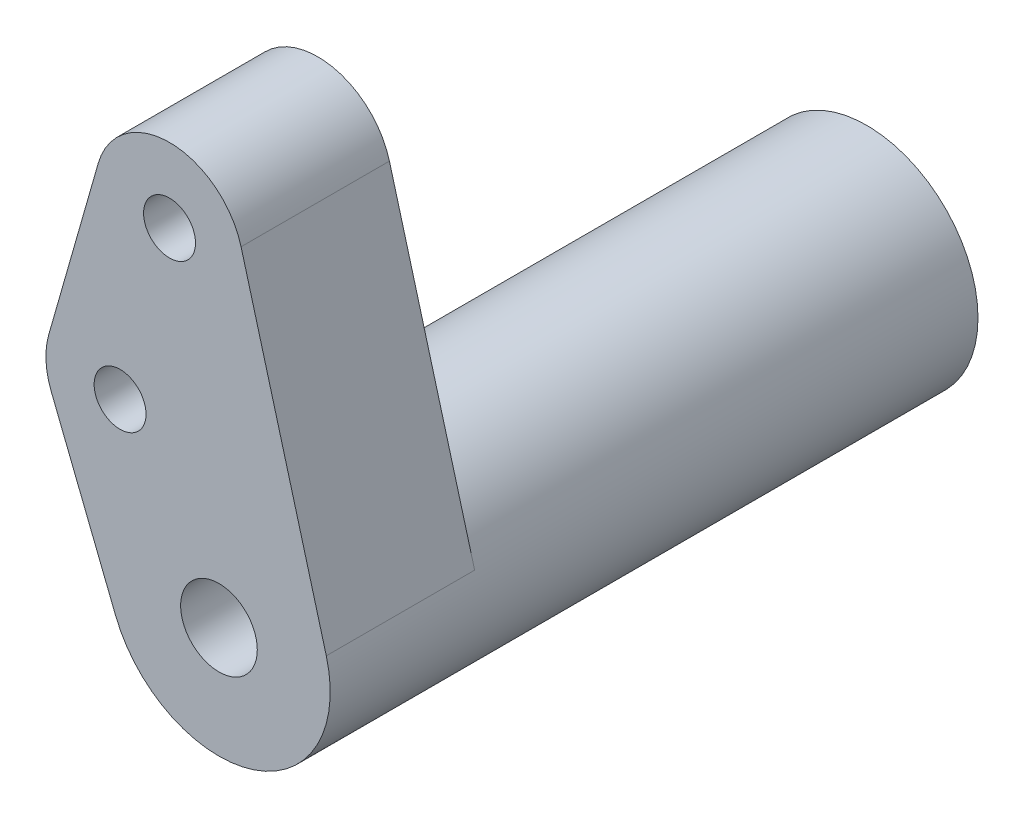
SolidWorks part; units mm, degrees
ref_plane "Alzado" through (0, 0, 0) normal (0, 0, 1) x (1, 0, 0)
ref_plane "Planta" through (0, 0, 0) normal (0, 1, 0) x (1, 0, 0)
ref_plane "Vista lateral" through (0, 0, 0) normal (1, 0, 0) x (0, 0, -1)
ref_plane "Plano1" through (0, 0, 14) normal (0, 0, 1) x (1, 0, 0)
sketch "Sk_Columna" plane through (0, 0, 14) normal (0, 0, 1) x (1, 0, 0)
  circle A0 centre (-36, -62) radius 9
  circle A1 centre (-36, -62) radius 3.1
extrude "Columna" add sketch "Sk_Columna" along normal blind 40.4
ref_plane "Plano2" through (0, 0, 54.4) normal (0, 0, 1) x (1, 0, 0)
sketch "Sk_Cuerpo_inferior" plane through (0, 0, 54.4) normal (0, 0, 1) x (1, 0, 0)
  line L0 (-49.5754, -52.2169) -> (-44.3631, -65.3254)
  line L1 (-27.3188, -59.626) -> (-34.2125, -34.4173)
  line L2 (-45.7691, -34.3517) -> (-49.7691, -48.3517)
  arc A0 (-44.3631, -65.3254) -> (-27.3188, -59.626) centre (-36, -62) ccw
  arc A1 (-34.2125, -34.4173) -> (-45.7691, -34.3517) centre (-40, -36) ccw
  arc A2 (-49.7691, -48.3517) -> (-49.5754, -52.2169) centre (-44, -50) ccw
  circle A3 centre (-40, -36) radius 2.1
  circle A4 centre (-44, -50) radius 2.1
  circle A5 centre (-36, -62) radius 3.1
extrude "Cuerpo_inferior" add sketch "Sk_Cuerpo_inferior" along normal blind 12
thread "Rosca1" pitch 0.3 start angle 0, offset 0, length 0, pitch 0.3, diameter 4.2
ref_plane "Plano3" through (-41.9, -50, 54.4) normal (0, -1, 0) x (1, 0, 0)
sketch "Perfil de rosca1" plane through (-41.9, -50, 54.4) normal (0, -1, 0) x (1, 0, 0)
  line L0 (0, 0) -> (0, 0.3) construction
  line L1 (0, 0) -> (0.1624, 0.0937)
  line L2 (0.1624, 0.0937) -> (0.1624, 0.1312)
  line L3 (0.1624, 0.1312) -> (0, 0.225)
  line L4 (0.1624, 0.1125) -> (0, 0.1125) construction
  line L11 (0, 0) -> (0, 0.225)
  point P2 (0, 0)
  dimension "Pitch" = 0.3
  dimension "Profile_Angle" = 60
  dimension "Profile_Land" = 0.0375
  dimension "Profile_Height" = 0.1624
thread "Rosca2" pitch 0.3 start angle 0, offset 0, length 0, pitch 0.3, diameter 4.2
ref_plane "Plano4" through (-37.9, -36, 54.4) normal (0, -1, 0) x (1, 0, 0)
sketch "Perfil de rosca2" plane through (-37.9, -36, 54.4) normal (0, -1, 0) x (1, 0, 0)
  line L0 (0, 0) -> (0, 0.3) construction
  line L1 (0, 0) -> (0.1624, 0.0937)
  line L2 (0.1624, 0.0937) -> (0.1624, 0.1312)
  line L3 (0.1624, 0.1312) -> (0, 0.225)
  line L4 (0.1624, 0.1125) -> (0, 0.1125) construction
  line L11 (0, 0) -> (0, 0.225)
  point P2 (0, 0)
  dimension "Pitch" = 0.3
  dimension "Profile_Angle" = 60
  dimension "Profile_Land" = 0.0375
  dimension "Profile_Height" = 0.1624
